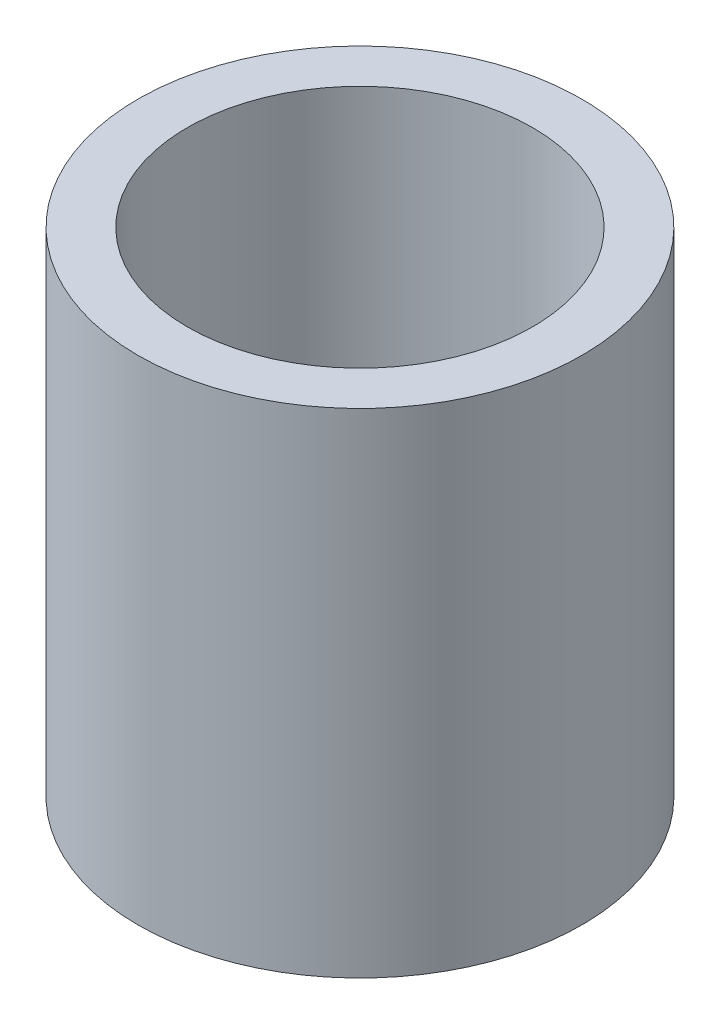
SolidWorks part; units mm, degrees
ref_plane "Front Plane" through (0, 0, 0) normal (0, 0, 1) x (1, 0, 0)
ref_plane "Top Plane" through (0, 0, 0) normal (0, 1, 0) x (1, 0, 0)
ref_plane "Right Plane" through (0, 0, 0) normal (1, 0, 0) x (0, 0, -1)
sketch "Sketch1" plane through (0, 0, 0) normal (0, 1, 0) x (1, 0, 0)
  circle A0 centre (0, 0) radius 22.5
  circle A1 centre (0, 0) radius 17.5
  dimension "D1" = 35
  dimension "D2" = 45
extrude "Extrude1" add sketch "Sketch1" along normal blind 50
